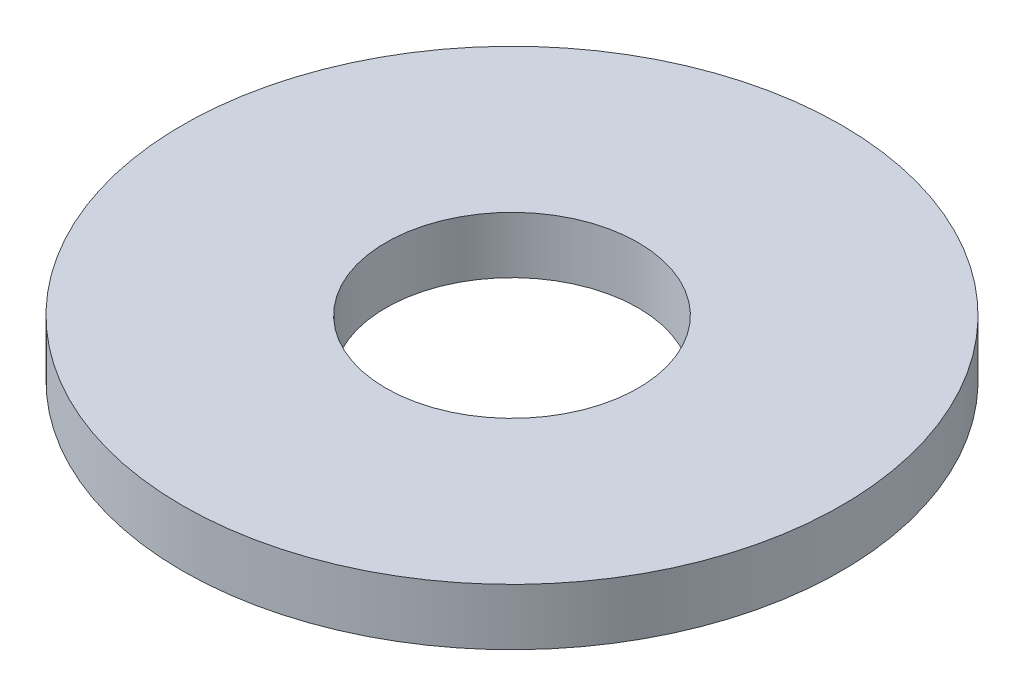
SolidWorks part; units mm, degrees
ref_plane "Front" through (0, 0, 0) normal (0, 0, 1) x (1, 0, 0)
ref_plane "Top" through (0, 0, 0) normal (0, 1, 0) x (1, 0, 0)
ref_plane "Right" through (0, 0, 0) normal (1, 0, 0) x (0, 0, -1)
sketch "Sketch1" plane through (0, 0, 0) normal (0, 0, 1) x (1, 0, 0)
  line L0 (0, -80.01) -> (0, 81.6102) construction
  line L1 (3.5687, 0) -> (3.5687, 1.6002)
  line L2 (3.5687, 1.6002) -> (9.3218, 1.6002)
  line L3 (9.3218, 1.6002) -> (9.3218, 0)
  line L4 (9.3218, 0) -> (3.5687, 0)
revolve "Base-Revolve" add sketch "Sketch1" angle 360 about L0
